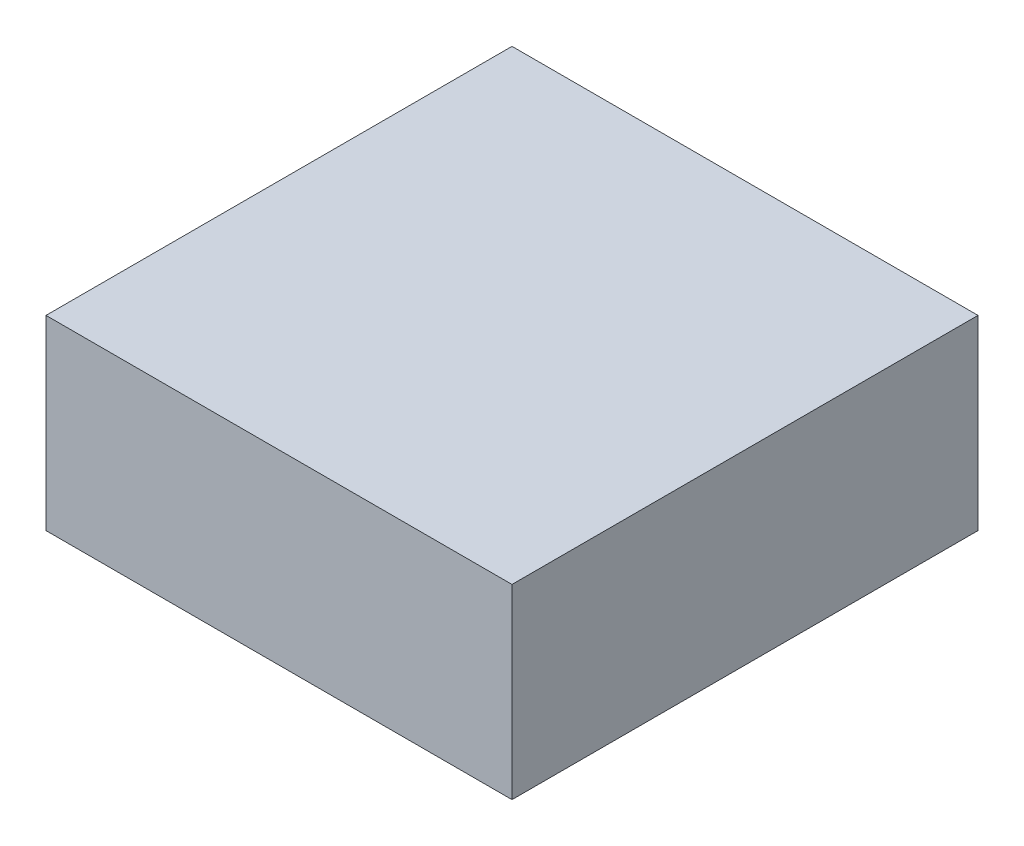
SolidWorks part; units mm, degrees
ref_plane "Front Plane" through (0, 0, 0) normal (0, 0, 1) x (1, 0, 0)
ref_plane "Top Plane" through (0, 0, 0) normal (0, 1, 0) x (1, 0, 0)
ref_plane "Right Plane" through (0, 0, 0) normal (1, 0, 0) x (0, 0, -1)
sketch "Sketch1" plane through (0, 0, 0) normal (0, 1, 0) x (1, 0, 0)
  line L1 (-75, -75) -> (75, -75)
  line L2 (-75, -75) -> (-75, 75)
  line L3 (-75, 75) -> (75, 75)
  line L4 (75, -75) -> (75, 75)
  line L5 (-75, -75) -> (75, 75) construction
  line L6 (-75, 75) -> (75, -75) construction
  point P0 (0, 0)
  dimension "D1" = 150
  dimension "D2" = 150
extrude "Boss-Extrude1" add sketch "Sketch1" along normal blind 60
